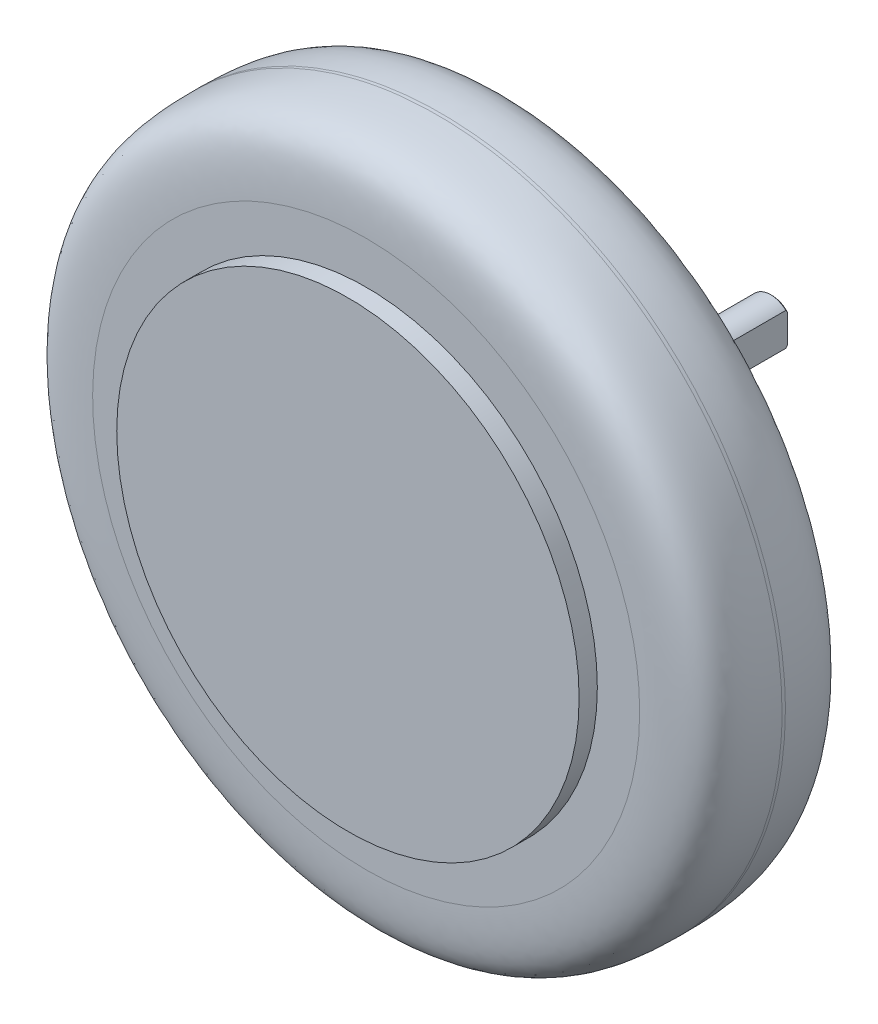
SolidWorks part; units mm, degrees
ref_plane "Front Plane" through (0, 0, 0) normal (0, 0, 1) x (1, 0, 0)
ref_plane "Top Plane" through (0, 0, 0) normal (0, 1, 0) x (1, 0, 0)
ref_plane "Right Plane" through (0, 0, 0) normal (1, 0, 0) x (0, 0, -1)
sketch "Sketch1" plane through (0, 0, 0) normal (0, 0, 1) x (1, 0, 0)
  circle A0 centre (0, 0) radius 8
  dimension "D1" = 16
extrude "Boss-Extrude1" add sketch "Sketch1" along normal blind 49.5
chamfer "Chamfer1" distance 0.508 angle 45 1 edges at (8, 0, 0)
ref_plane "Plane1" through (0, 0, 2.5) normal (0, 0, -1) x (-1, 0, 0)
sketch "Sketch2" plane through (0, 0, 2.5) normal (0, 0, -1) x (-1, 0, 0)
  line L0 (-5.44, -5.8657) -> (-5.44, 5.8657)
  line L1 (-8, 0) -> (8, 0) construction
  circle A0 centre (0, 0) radius 8 construction
  arc A1 (-5.44, 5.8657) -> (-5.44, -5.8657) centre (0, 0) ccw
  point P9 (-5.44, 0)
  dimension "D1" = 13.44
extrude "Cut-Extrude1" cut sketch "Sketch2" against normal blind 43.8
sketch "Sketch3" plane through (0, 0, 49.5) normal (0, 0, 1) x (1, 0, 0)
  circle A0 centre (0, 0) radius 7.7
  dimension "D1" = 15.4
extrude "Boss-Extrude2" add sketch "Sketch3" along normal blind 1.8
sketch "Sketch4" plane through (0, 0, 51.3) normal (0, 0, 1) x (1, 0, 0)
  circle A0 centre (0, 0) radius 8.435
  dimension "D1" = 16.87
extrude "Boss-Extrude3" add sketch "Sketch4" along normal blind 23
ref_plane "Plane2" through (0, 0, 69.3) normal (0, 0, -1) x (-1, 0, 0)
sketch "Sketch5" plane through (0, 0, 69.3) normal (0, 0, -1) x (-1, 0, 0)
  circle A0 centre (0, 0) radius 23
  circle A1 centre (0, 0) radius 13.75
  dimension "D1" = 27.5
  dimension "D2" = 46
extrude "Boss-Extrude4" add sketch "Sketch5" against normal blind 8.84 separate body
sketch "Sketch6" plane through (0, 0, 74.3) normal (0, 0, 1) x (1, 0, 0)
  circle A0 centre (0, 0) radius 63
  dimension "D1" = 126
extrude "Boss-Extrude5" add sketch "Sketch6" along normal blind 16
chamfer "Chamfer2" distance 15.24 angle 45 1 edges at (63, 0, 74.3)
sketch "Sketch7" plane through (0, 0, 90.3) normal (0, 0, 1) x (1, 0, 0)
  circle A0 centre (0, 0) radius 83
  dimension "D1" = 166
extrude "Boss-Extrude6" add sketch "Sketch7" along normal blind 2.54
sketch "Sketch8" plane through (0, 0, 90.3) normal (0, 0, -1) x (-1, 0, 0)
  circle A0 centre (0, 0) radius 71
  circle A1 centre (0, 0) radius 83
  circle A2 centre (0, 0) radius 83 construction
  dimension "D1" = 142
extrude "Boss-Extrude7" add sketch "Sketch8" along normal blind 6.5
chamfer "Chamfer3" distance 5.08 angle 45 1 edges at (-71, 0, 83.8)
sketch "Sketch9" plane through (0, 0, 92.84) normal (0, 0, 1) x (1, 0, 0)
  circle A0 centre (0, 0) radius 123
  dimension "D1" = 246
extrude "Boss-Extrude8" add sketch "Sketch9" along normal blind 52
fillet "Fillet1" radius 25.4 2 edges at (123, 0, 144.84) (123, 0, 92.84)
sketch "Sketch10" plane through (0, 0, 144.84) normal (0, 0, 1) x (1, 0, 0)
  circle A0 centre (0, 0) radius 82.5
  dimension "D1" = 165
extrude "Boss-Extrude9" add sketch "Sketch10" along normal blind 6.5
sketch "Sketch11" plane through (5.44, 0, 0) normal (1, 0, 0) x (0, 0, -1)
  line L0 (-118.84, -123) -> (-118.84, 123) construction
  line L1 (-119.44, -123) -> (-118.24, -123) construction
  line L2 (-118.24, 123) -> (-119.44, 123) construction
sketch "Sketch13" plane through (5.44, 0, 0) normal (1, 0, 0) x (0, 0, -1)
  line L0 (-46.3, 5.8657) -> (-2.5, 5.8657) construction
  line L1 (-46.3, 5.8657) -> (4.5, 5.8657)
  line L2 (-46.3, 5.8657) -> (-46.3, -5.8657)
  line L3 (-46.3, -5.8657) -> (4.5, -5.8657)
  line L4 (4.5, 5.8657) -> (4.5, -5.8657)
  line L5 (-46.3, -5.8657) -> (-2.5, -5.8657) construction
  line L6 (-46.3, -5.8657) -> (-46.3, 5.8657) construction
  dimension "D1" = 50.8
extrude "Cut-Extrude2" cut sketch "Sketch13" along normal blind 5.08
